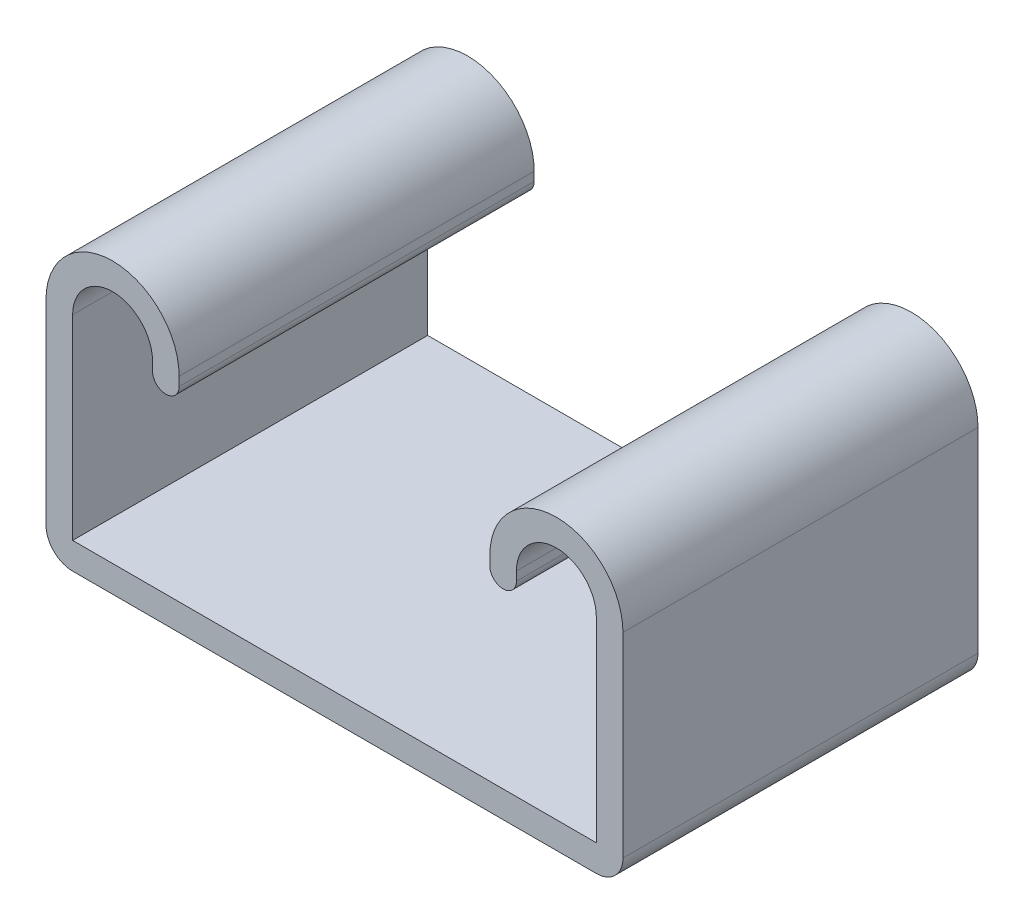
SolidWorks part; units mm, degrees
ref_plane "Plane1" through (0, 0, 0) normal (0, 0, 1) x (1, 0, 0)
ref_plane "Plane2" through (0, 0, 0) normal (0, 1, 0) x (1, 0, 0)
ref_plane "Plane3" through (0, 0, 0) normal (1, 0, 0) x (0, 0, -1)
sketch "Sketch1" plane through (0, 0, 0) normal (0, 0, 1) x (1, 0, 0)
  line L0 (-20.6375, 7.4295) -> (-20.6375, -6.5532)
  line L1 (-18.7325, -8.4582) -> (18.7325, -8.4582)
  line L2 (20.6375, -6.5532) -> (20.6375, 7.4295)
  line L3 (11.1125, 7.4295) -> (11.1125, 6.7945)
  line L4 (-11.1125, 7.4295) -> (-11.1125, 6.7945)
  line L5 (-13.0175, 7.4295) -> (-13.0175, 6.7945)
  line L6 (-18.7325, 7.4295) -> (-18.7325, -6.5532)
  line L7 (-18.7325, -6.5532) -> (18.7325, -6.5532)
  line L8 (18.7325, -6.5532) -> (18.7325, 7.4295)
  line L9 (13.0175, 7.4295) -> (13.0175, 6.7945)
  line L10 (-25.4, 12.192) -> (25.4, 12.192) construction
  line L11 (-12.8524, 5.842) -> (12.8524, 5.842) construction
  arc A0 (20.6375, 7.4295) -> (11.1125, 7.4295) centre (15.875, 7.4295) ccw
  arc A1 (-20.6375, 7.4295) -> (-11.1125, 7.4295) centre (-15.875, 7.4295) cw
  arc A2 (-18.7325, -8.4582) -> (-20.6375, -6.5532) centre (-18.7325, -6.5532) cw
  arc A3 (18.7325, -8.4582) -> (20.6375, -6.5532) centre (18.7325, -6.5532) ccw
  arc A4 (-18.7325, 7.4295) -> (-13.0175, 7.4295) centre (-15.875, 7.4295) cw
  arc A5 (18.7325, 7.4295) -> (13.0175, 7.4295) centre (15.875, 7.4295) ccw
  arc A6 (11.1125, 6.7945) -> (13.0175, 6.7945) centre (12.065, 6.7945) ccw
  arc A7 (-11.1125, 6.7945) -> (-13.0175, 6.7945) centre (-12.065, 6.7945) cw
  dimension "D1" = 1.905
  dimension "D3" = 20.6375
  dimension "Width" = 41.275
  dimension "D5" = 8.4582
  dimension "D6" = 9.525
  dimension "D7" = 22.225
  dimension "D8" = 12.192
  dimension "D9" = 6.35
  dimension "gauge" = 1.905
extrude "Base-Extrude" add sketch "Sketch1" along normal mid plane 25.4
equation "\"D3@Sketch1\" = \"Width@Sketch1\" / 2"
equation "\"D7@Sketch1\" = \"Width@Sketch1\" - 2 * \"D6@Sketch1\""
equation "\"D1@Sketch1\" = \"gauge@Sketch1\""
